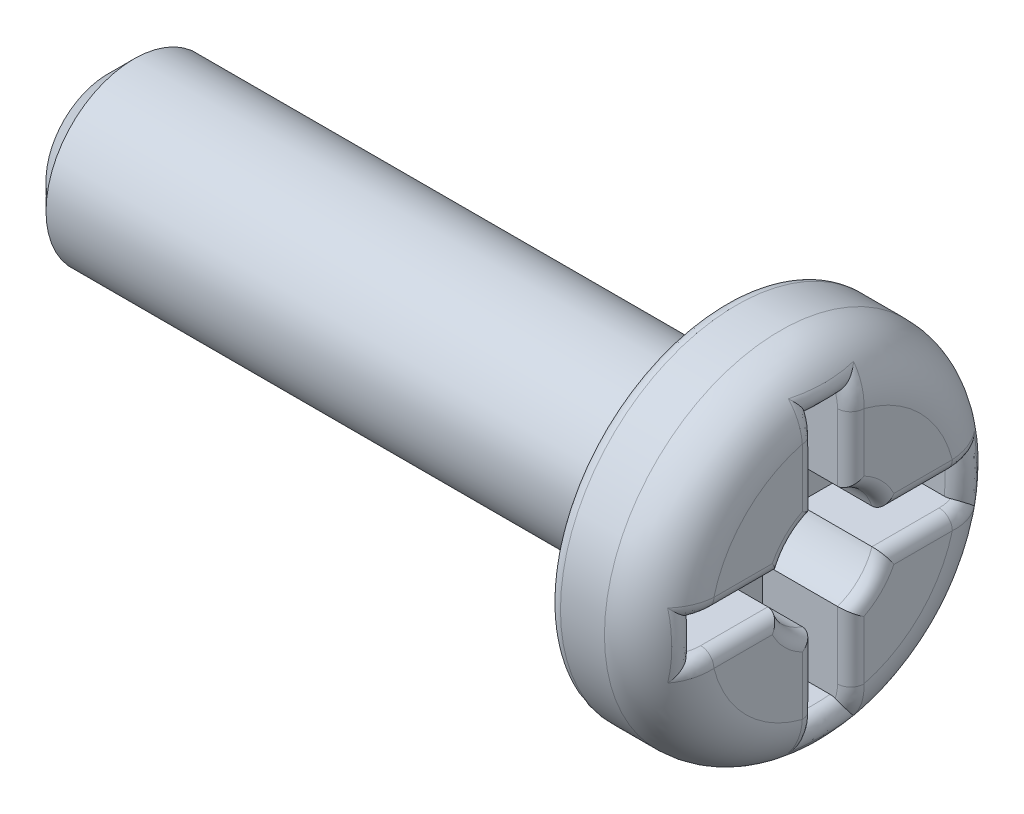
SolidWorks part; units mm, degrees
ref_plane "Face" through (0, 0, 0) normal (0, 0, 1) x (1, 0, 0)
ref_plane "Dessus" through (0, 0, 0) normal (0, 1, 0) x (1, 0, 0)
ref_plane "Droite" through (0, 0, 0) normal (1, 0, 0) x (0, 0, -1)
sketch "Esquisse1" plane through (0, 0, 0) normal (0, 0, 1) x (1, 0, 0)
  line L0 (0, 0) -> (5, 0) construction
  line L1 (0, 0) -> (0, 1)
  line L2 (0, 1) -> (7, 1)
  line L3 (7, 1) -> (7, 2)
  line L4 (7, 2) -> (7.65, 2)
  line L5 (8.25, 1.4) -> (8.25, 0)
  line L6 (0, 0) -> (8.25, 0)
  arc A0 (7.65, 2) -> (8.25, 1.4) centre (7.65, 1.4) cw
  point P10 (8.25, 2)
  dimension "D5" = 0.6
  dimension "D1" = 2
  dimension "D2" = 7
  dimension "D3" = 1.25
  dimension "D4" = 4
revolve "Révolution1" add sketch "Esquisse1" angle 360 about L0
sketch "Esquisse2" plane through (8.25, 0, 0) normal (1, 0, 0) x (0, 0, -1)
  line L0 (0, 0) -> (0, 2.6874) construction
  line L1 (0.2, 0) -> (-0.2, 0)
  line L2 (-0.2, 0) -> (-0.2, 1.5)
  line L3 (0.2, 0) -> (0.2, 1.5)
  line L4 (-0.2, 1.5) -> (0.2, 1.5)
  point P8 (0, 1.5)
  dimension "D1" = 0.4
  dimension "D2" = 1.5
extrude "Enlèv. mat.-Extru.1" cut sketch "Esquisse2" against normal blind 1
pattern_circular "Répétition circulaire1" count 4 over 360 about axis through (0, 0, 0) along (1, 0, 0)
sketch "Esquisse3" plane through (8.25, 0, 0) normal (1, 0, 0) x (0, 0, -1)
  circle A0 centre (0, 0) radius 0.625
  dimension "D1" = 1.25
extrude "Enlèv. mat.-Extru.2" cut sketch "Esquisse3" against normal up to surface (1 mm away)
fillet "Congé2" radius 0.15
chamfer "Chanfrein1" distance 0.3 angle 45
